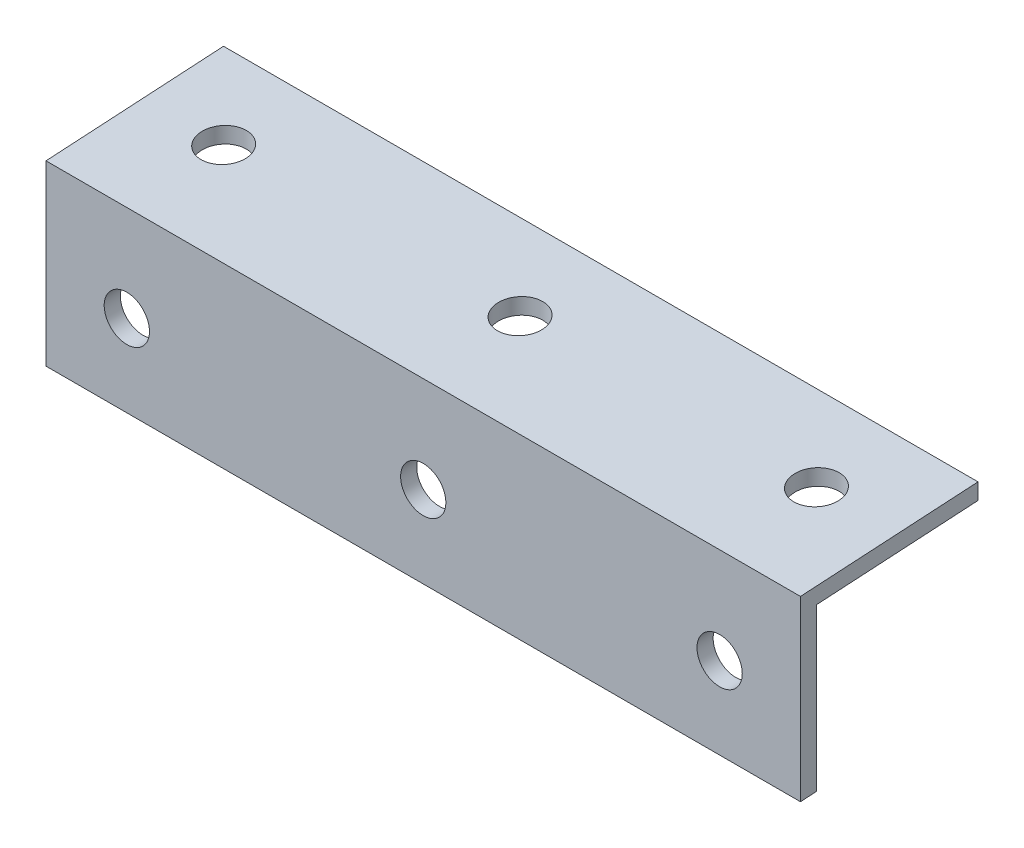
SolidWorks part; units mm, degrees
ref_plane "Front Plane" through (0, 0, 0) normal (1, 0, 0) x (0, 1, 0)
ref_plane "Top Plane" through (0, 0, 0) normal (0, 0, 1) x (0, 1, 0)
ref_plane "Right Plane" through (0, 0, 0) normal (0, 1, 0) x (-1, 0, 0)
sketch "Sketch1" plane through (0, 0, 0) normal (1, 0, 0) x (0, 1, 0)
  line L0 (-19.05, 0) -> (0, 0)
  line L1 (0, 0) -> (1.1206, -19.017)
  line L2 (1.1206, -19.017) -> (3.0256, -19.017)
  line L3 (3.0256, -19.017) -> (1.7929, 1.9017)
  line L4 (1.7929, 1.9017) -> (-19.1621, 1.9017)
  line L5 (-19.1621, 1.9017) -> (-19.05, 0)
extrude "Bent_corner_brace" add sketch "Sketch1" along normal blind 88.9
sketch "Sketch2" plane through (0, 0, 0) normal (0, 0, 1) x (0, 1, 0)
  circle A0 centre (-9.525, -9.525) radius 2.667
  circle A1 centre (-9.525, -44.45) radius 2.667
  circle A2 centre (-9.525, -79.375) radius 2.667
extrude "Top_flange_screw_holes" cut sketch "Sketch2" against normal through all and the other way through all
sketch "Sketch3" plane through (0, 0, 0) normal (0, 1, 0) x (-1, 0, 0)
  circle A0 centre (-9.525, -9.5085) radius 2.667
  circle A1 centre (-44.45, -9.5085) radius 2.667
  circle A2 centre (-79.375, -9.5085) radius 2.667
extrude "Side_flange_screw_holes" cut sketch "Sketch3" against normal through all and the other way through all
